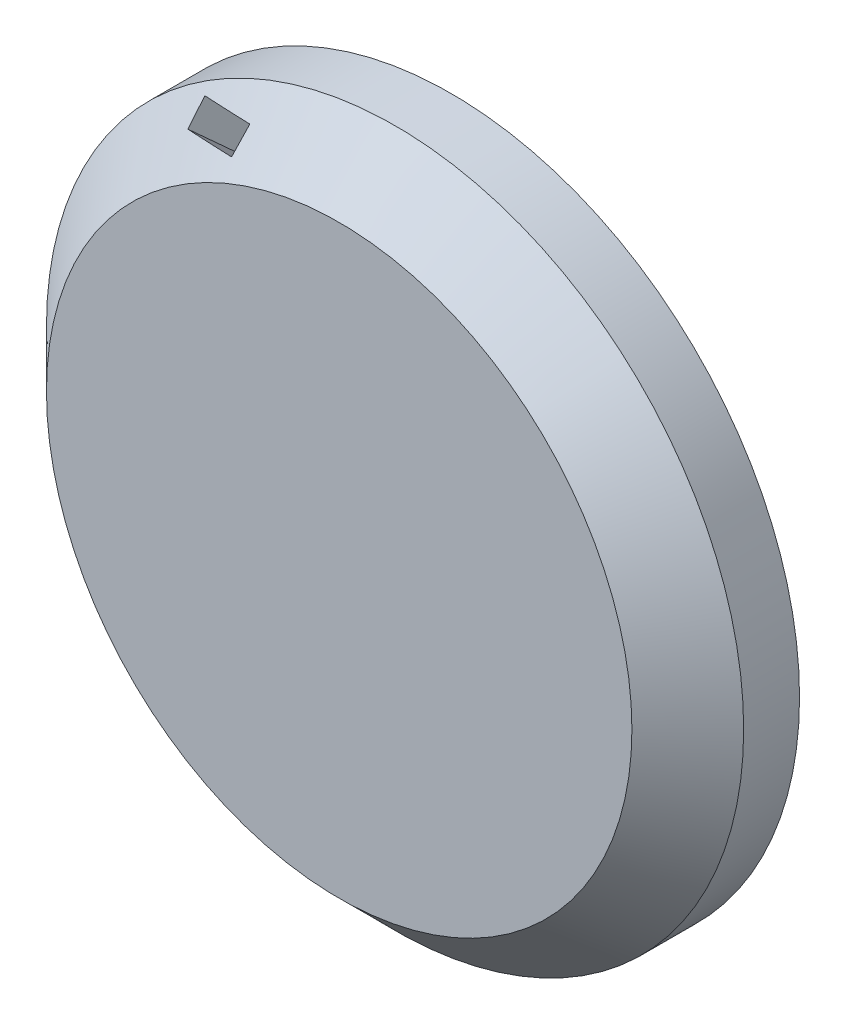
SolidWorks part; units mm, degrees
ref_plane "vorn" through (0, 0, 0) normal (0, 0, 1) x (1, 0, 0)
ref_plane "oben" through (0, 0, 0) normal (0, 1, 0) x (1, 0, 0)
ref_plane "rechts" through (0, 0, 0) normal (1, 0, 0) x (0, 0, -1)
sketch "Skizze1" plane through (0, 0, 0) normal (0, 0, 1) x (1, 0, 0)
  circle A0 centre (0, 0) radius 62.3893
extrude "Linear austragen1" add sketch "Skizze1" against normal blind 20
chamfer "Fase1" distance 10 angle 45 1 edges at (62.3893, 0, 0)
sketch "Skizze2" plane through (0, 0, 0) normal (0, 0, 1) x (1, 0, 0)
  line L0 (0, 0) -> (-26.1947, 45.3705) construction
  line L1 (0, 0) -> (0, 32.0342) construction
  line L2 (-94.0128, 6.2157) -> (56.3224, 93.0117) construction
  circle A0 centre (0, 0) radius 52.3893 construction
  dimension "D1" = 30
ref_plane "Ebene1" through (-26.1947, 45.3705, 0) normal (-0.5, 0.866, 0) x (-0.866, -0.5, 0)
ref_plane "Ebene2" through (-13.0973, 22.6852, 26.1947) normal (-0.3536, 0.6124, 0.7071) x (0.9354, 0.2315, 0.2673)
sketch "Skizze3" plane through (-13.0973, 22.6852, 26.1947) normal (-0.3536, 0.6124, 0.7071) x (0.9354, 0.2315, 0.2673)
  line L1 (-20.8252, 39.735) -> (-9.3631, 39.735)
  line L2 (-20.8252, 39.735) -> (-20.8252, 44.4943)
  line L3 (-20.8252, 44.4943) -> (-9.3631, 44.4943)
  line L4 (-9.3631, 39.735) -> (-9.3631, 44.4943)
extrude "Schnitt-Linear austragen1" cut sketch "Skizze3" against normal blind 10
